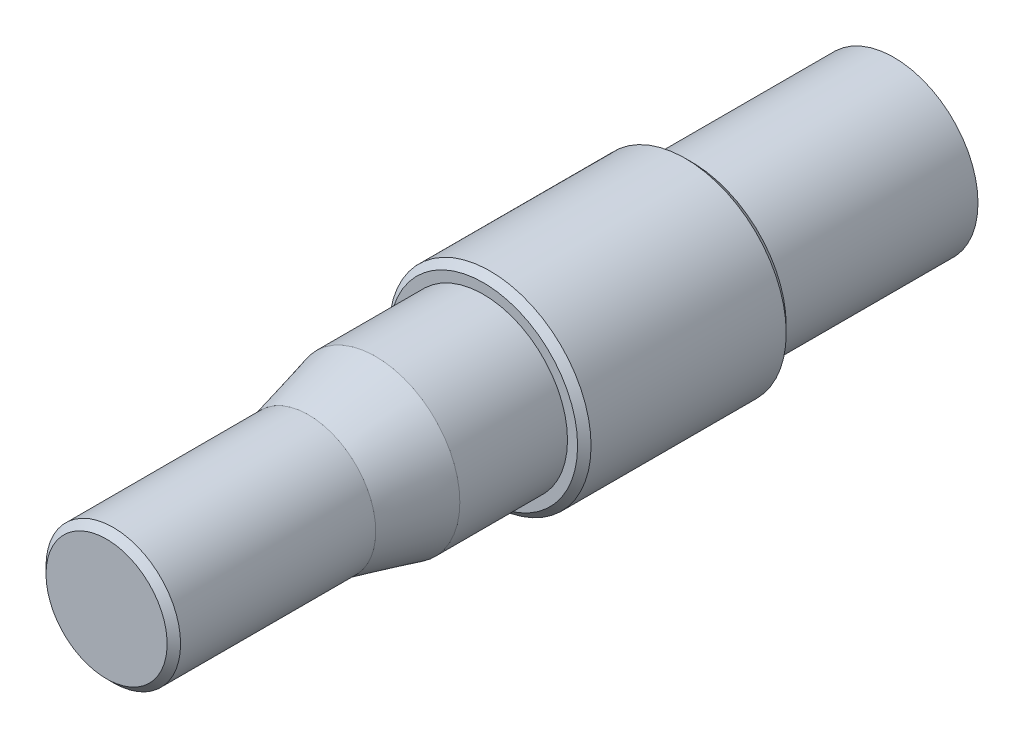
SolidWorks part; units mm, degrees
ref_plane "Plan de face" through (0, 0, 0) normal (0, 0, 1) x (1, 0, 0)
ref_plane "Plan de dessus" through (0, 0, 0) normal (0, 1, 0) x (1, 0, 0)
ref_plane "Plan de droite" through (0, 0, 0) normal (1, 0, 0) x (0, 0, -1)
sketch "Esquisse1" plane through (0, 0, 0) normal (0, 0, 1) x (1, 0, 0)
  circle A0 centre (0, 0) radius 12.5
  dimension "D1" = 25
extrude "Extrusion1" add sketch "Esquisse1" against normal blind 30
sketch "Esquisse2" plane through (0, 0, 0) normal (0, 0, 1) x (1, 0, 0)
  circle A0 centre (0, 0) radius 15
  dimension "D1" = 30
extrude "Extrusion2" add sketch "Esquisse2" along normal blind 31
chamfer "Chanfrein1" distance 1 angle 45 2 edges at (15, 0, 0) (15, 0, 31)
sketch "Esquisse3" plane through (0, 0, 31) normal (0, 0, 1) x (1, 0, 0)
  circle A0 centre (0, 0) radius 12.5
  dimension "D1" = 25
extrude "Extrusion3" add sketch "Esquisse3" along normal blind 16
sketch "Esquisse4" plane through (0, 0, 0) normal (1, 0, 0) x (0, 0, -1)
  line L0 (-47, 12.5) -> (-57, 10)
  line L1 (-57, 10) -> (-87, 10)
  line L2 (-87, 10) -> (-87, 0)
  line L3 (-87, 0) -> (-47, 0)
  line L4 (-47, 12.5) -> (-47, -12.5) construction
  line L5 (-47, 0) -> (-47, 12.5)
  line L6 (-47, 0) -> (-31, 0) construction
  dimension "D1" = 10
  dimension "D2" = 10
  dimension "D3" = 40
revolve "Révolution1" add sketch "Esquisse4" angle 360 about axis through (0, 0, 47) along (0, 0, -1)
chamfer "Chanfrein2" distance 1 angle 45 1 edges at (10, 0, 87)
